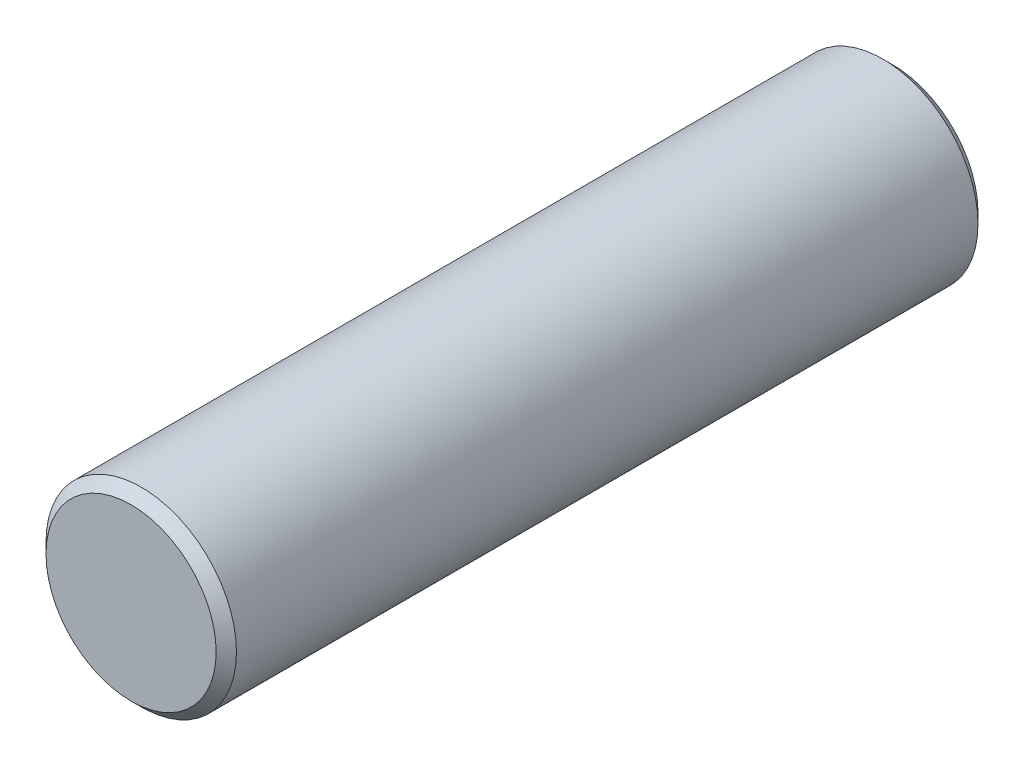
SolidWorks part; units mm, degrees
ref_plane "Front Plane" through (0, 0, 0) normal (0, 0, 1) x (1, 0, 0)
ref_plane "Top Plane" through (0, 0, 0) normal (0, 1, 0) x (1, 0, 0)
ref_plane "Right Plane" through (0, 0, 0) normal (1, 0, 0) x (0, 0, -1)
sketch "Sketch1" plane through (0, 0, 0) normal (0, 0, 1) x (1, 0, 0)
  circle A0 centre (0, 0) radius 1.1906
  dimension "D1" = 2.3813
extrude "Extrude1" add sketch "Sketch1" along normal blind 9.525
chamfer "Chamfer1" distance 0.127 angle 45 2 edges at (1.1906, 0, 9.525) (1.1906, 0, 0)
